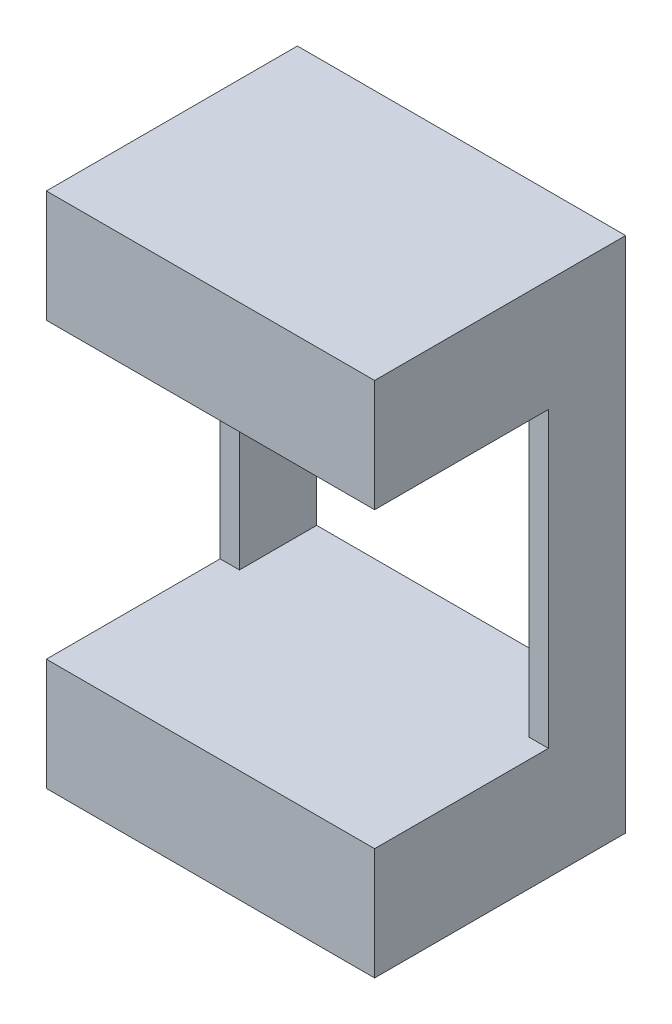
SolidWorks part; units mm, degrees
ref_plane "Front Plane" through (0, 0, 0) normal (0, 0, 1) x (1, 0, 0)
ref_plane "Top Plane" through (0, 0, 0) normal (0, 1, 0) x (1, 0, 0)
ref_plane "Right Plane" through (0, 0, 0) normal (1, 0, 0) x (0, 0, -1)
sketch "Sketch1" plane through (0, 0, 0) normal (0, 0, 1) x (1, 0, 0)
  line L1 (0, 0) -> (11.25, 0)
  line L2 (0, 0) -> (0, 19)
  line L3 (0, 19) -> (11.25, 19)
  line L4 (11.25, 0) -> (11.25, 19)
  line L5 (-0.75, 23.75) -> (12, 23.75)
  line L6 (-0.75, 23.75) -> (-0.75, -4.75)
  line L7 (-0.75, -4.75) -> (12, -4.75)
  line L8 (12, 23.75) -> (12, -4.75)
  point P9 (-0.75, 9.5)
  point P10 (0, 9.5)
  point P11 (5.625, 23.75)
  point P12 (5.625, 19)
  dimension "D1" = 11.25
  dimension "D2" = 19
  dimension "D3" = 28.5
  dimension "D4" = 12.75
extrude "Boss-Extrude1" add sketch "Sketch1" along normal blind 9
sketch "Sketch2" plane through (0, 0, 9) normal (0, 0, 1) x (1, 0, 0)
  line L0 (0, 19) -> (0, 0) construction
  line L1 (0, 15.7) -> (11.25, 15.7)
  line L2 (0, 15.7) -> (0, 15.2)
  line L3 (0, 15.2) -> (11.25, 15.2)
  line L4 (11.25, 15.7) -> (11.25, 15.2)
  line L5 (11.25, 0) -> (11.25, 19) construction
  line L6 (0, 0) -> (11.25, 0) construction
  line L7 (0, 3.8) -> (11.25, 3.8)
  line L8 (0, 3.8) -> (0, 3.3)
  line L9 (0, 3.3) -> (11.25, 3.3)
  line L10 (11.25, 3.8) -> (11.25, 3.3)
  line L11 (11.25, 19) -> (0, 19) construction
  line L12 (5.625, 15.2) -> (5.625, 16.2) construction
  line L13 (4.125, 15.2) -> (4.125, 16.2)
  line L14 (7.125, 15.2) -> (7.125, 16.2)
  line L15 (5.625, 3.8) -> (5.625, 2.8) construction
  line L16 (7.125, 3.8) -> (7.125, 2.8)
  line L17 (4.125, 3.8) -> (4.125, 2.8)
  arc A0 (4.125, 15.2) -> (7.125, 15.2) centre (5.625, 15.2) ccw
  arc A1 (7.125, 16.2) -> (4.125, 16.2) centre (5.625, 16.2) ccw
  arc A2 (7.125, 3.8) -> (4.125, 3.8) centre (5.625, 3.8) ccw
  arc A3 (4.125, 2.8) -> (7.125, 2.8) centre (5.625, 2.8) ccw
  point P18 (5.625, 15.7)
  point P23 (5.625, 3.3)
  point P24 (5.625, 15.7)
  point P33 (5.625, 3.3)
  dimension "D4" = 1.5
  dimension "D1" = 3.3
  dimension "D2" = 3.3
  dimension "D3" = 0.5
  dimension "D5" = 1
extrude "Boss-Extrude2" add sketch "Sketch2" against normal up to surface (9 mm away) contours L17 L7 L9 M22 | L17 A3 L16 L9 | L14 A1 L13 L1
sketch "Sketch3" plane through (-0.75, 0, 0) normal (-1, 0, 0) x (0, 0, 1)
  line L0 (0, 15.2) -> (9, 15.2) construction
  line L1 (3, 15.2) -> (9, 15.2)
  line L2 (3, 15.2) -> (3, 3.8)
  line L3 (3, 3.8) -> (9, 3.8)
  line L4 (9, 15.2) -> (9, 3.8)
  line L5 (0, 3.8) -> (9, 3.8) construction
  line L6 (9, 23.75) -> (9, -4.75) construction
  dimension "D1" = 6
extrude "Cut-Extrude1" cut sketch "Sketch3" against normal up to surface (12.75 mm away)
sketch "Sketch5" plane through (0, 0, 9) normal (0, 0, 1) x (1, 0, 0)
  line L0 (-0.75, -4.75) -> (12, -4.75) construction
  line L1 (-0.75, -0.55) -> (12, -0.55)
  line L2 (-0.75, -0.55) -> (-0.75, -4.75)
  line L3 (-0.75, -4.75) -> (12, -4.75)
  line L4 (12, -0.55) -> (12, -4.75)
  line L5 (-0.75, 3.8) -> (-0.75, -4.75) construction
  line L6 (12, -4.75) -> (12, 3.8) construction
  dimension "D1" = 4.2
extrude "Cut-Extrude2" cut sketch "Sketch5" against normal offset from surface (8.6 mm away) 0.4
sketch "Sketch6" plane through (0, 0, 9) normal (0, 0, 1) x (1, 0, 0)
  line L0 (-0.75, 23.75) -> (-0.75, 15.2) construction
  line L1 (-0.75, 23.75) -> (12, 23.75)
  line L2 (-0.75, 23.75) -> (-0.75, 19.55)
  line L3 (-0.75, 19.55) -> (12, 19.55)
  line L4 (12, 23.75) -> (12, 19.55)
  line L5 (12, 23.75) -> (-0.75, 23.75) construction
  line L6 (12, 15.2) -> (12, 23.75) construction
  dimension "D1" = 4.2
extrude "Cut-Extrude3" cut sketch "Sketch6" against normal offset from surface (8.6 mm away) 0.4
sketch "Sketch9" plane through (0, 0, 0) normal (0, 0, -1) x (-1, 0, 0)
  line L0 (0.75, 23.75) -> (0.75, -4.75) construction
  line L1 (-12, 23.75) -> (0.75, 23.75)
  line L2 (-12, 23.75) -> (-12, 19.55)
  line L3 (-12, 19.55) -> (0.75, 19.55)
  line L4 (0.75, 23.75) -> (0.75, 19.55)
  line L6 (-12, -4.75) -> (0.75, -4.75)
  line L7 (-12, -4.75) -> (-12, -0.55)
  line L8 (-12, -0.55) -> (0.75, -0.55)
  line L9 (0.75, -4.75) -> (0.75, -0.55)
extrude "Cut-Extrude6" cut sketch "Sketch9" against normal blind 10
sketch "Sketch10" plane through (0, 0, 9) normal (0, 0, 1) x (1, 0, 0)
  line L1 (-0.75, 19.55) -> (12, 19.55)
  line L2 (-0.75, 19.55) -> (-0.75, 15.2)
  line L3 (-0.75, 15.2) -> (12, 15.2)
  line L4 (12, 19.55) -> (12, 15.2)
  line L5 (-0.75, 3.8) -> (12, 3.8)
  line L6 (-0.75, 3.8) -> (-0.75, -0.55)
  line L7 (-0.75, -0.55) -> (12, -0.55)
  line L8 (12, 3.8) -> (12, -0.55)
extrude "Boss-Extrude3" add sketch "Sketch10" along normal blind 0.75
